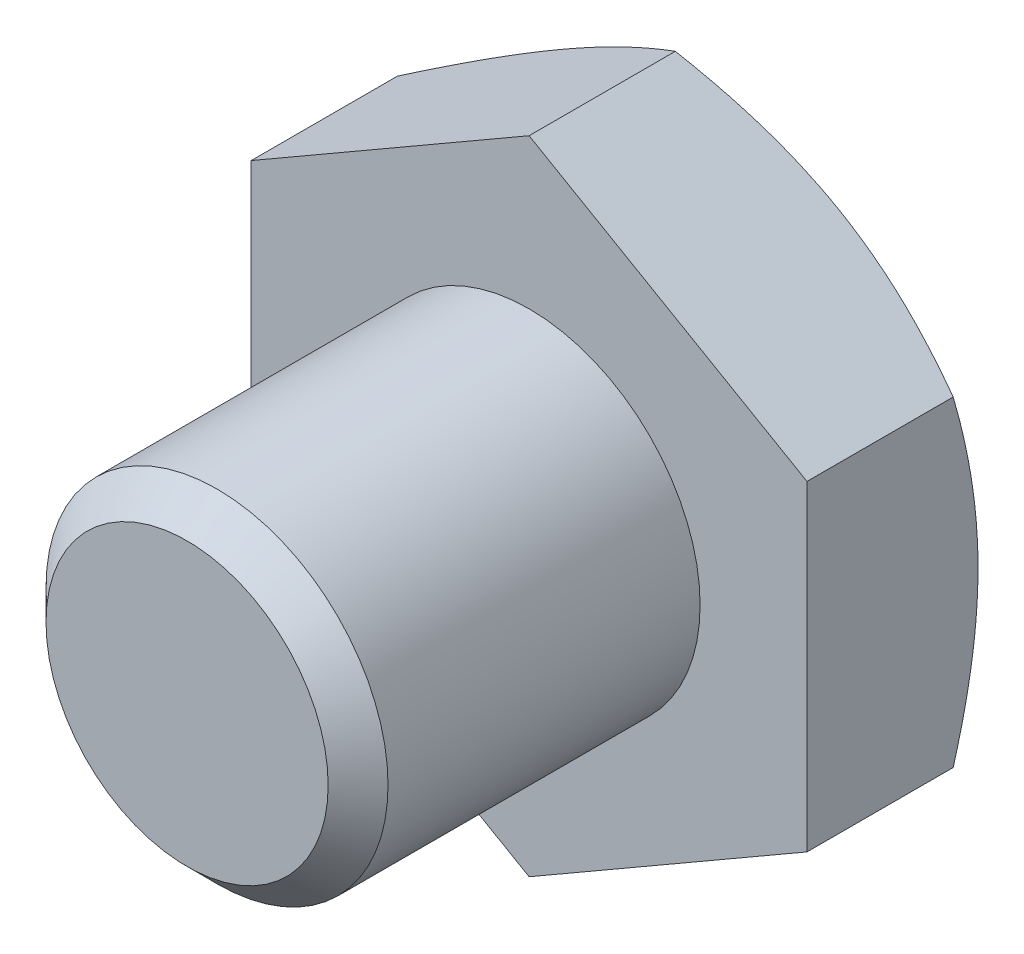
SolidWorks part; units mm, degrees
ref_plane "Plan1" through (0, 0, 0) normal (0, 0, 1) x (1, 0, 0)
ref_plane "Plan2" through (0, 0, 0) normal (0, 1, 0) x (1, 0, 0)
ref_plane "Plan3" through (0, 0, 0) normal (1, 0, 0) x (0, 0, -1)
sketch "Esquisse1" plane through (0, 0, 0) normal (0, 1, 0) x (1, 0, 0)
  line L1 (0, 0) -> (0, -8) construction
  line L2 (0, 0) -> (4, 0)
  line L3 (0, 0) -> (0, -8)
  line L4 (0, -8) -> (4, -8)
  line L6 (4, 0) -> (4, -8)
  dimension "D1" = 8
  dimension "D2" = 4
revolve "Base-Révolution" add sketch "Esquisse1"
chamfer "Chanfrein1" distance 0.7 angle 45
sketch "Esquisse6" plane through (0, 0, 0) normal (0, 0, 1) x (1, 0, 0)
  line L0 (0, 0) -> (6.5, 0) construction
  line L1 (6.5, -3.7528) -> (6.5, 3.7528)
  line L2 (0, 0) -> (6.5, 3.7528) construction
  line L3 (0, 7.5056) -> (6.5, 3.7528)
  line L4 (0, -7.5056) -> (6.5, -3.7528)
  line L5 (0, 0) -> (0, 6.5) construction
  line L6 (-6.5, -3.7528) -> (-6.5, 3.7528)
  line L7 (-6.5, 3.7528) -> (0, 7.5056)
  line L8 (0, -7.5056) -> (-6.5, -3.7528)
  circle A0 centre (0, 0) radius 6.5 construction
  dimension "D2" = 30
  dimension "D1" = 13
extrude "Boss.-Extru.1" add sketch "Esquisse6" against normal blind 4
sketch "Esquisse7" plane through (0, 0, 0) normal (0, 1, 0) x (1, 0, 0)
  line L0 (-6.5, 4) -> (-13.4282, 4)
  line L1 (-6.5, 4) -> (-13.4282, 0)
  line L2 (-13.4282, 4) -> (-13.4282, 0)
  line L3 (0, 6.2394) -> (0, 0) construction
  line L4 (0, -7.3) -> (0, -8) construction
  dimension "D1" = 30
revolve "Enlèvement de matière-Révolution1" cut sketch "Esquisse7" angle 360 about L3
